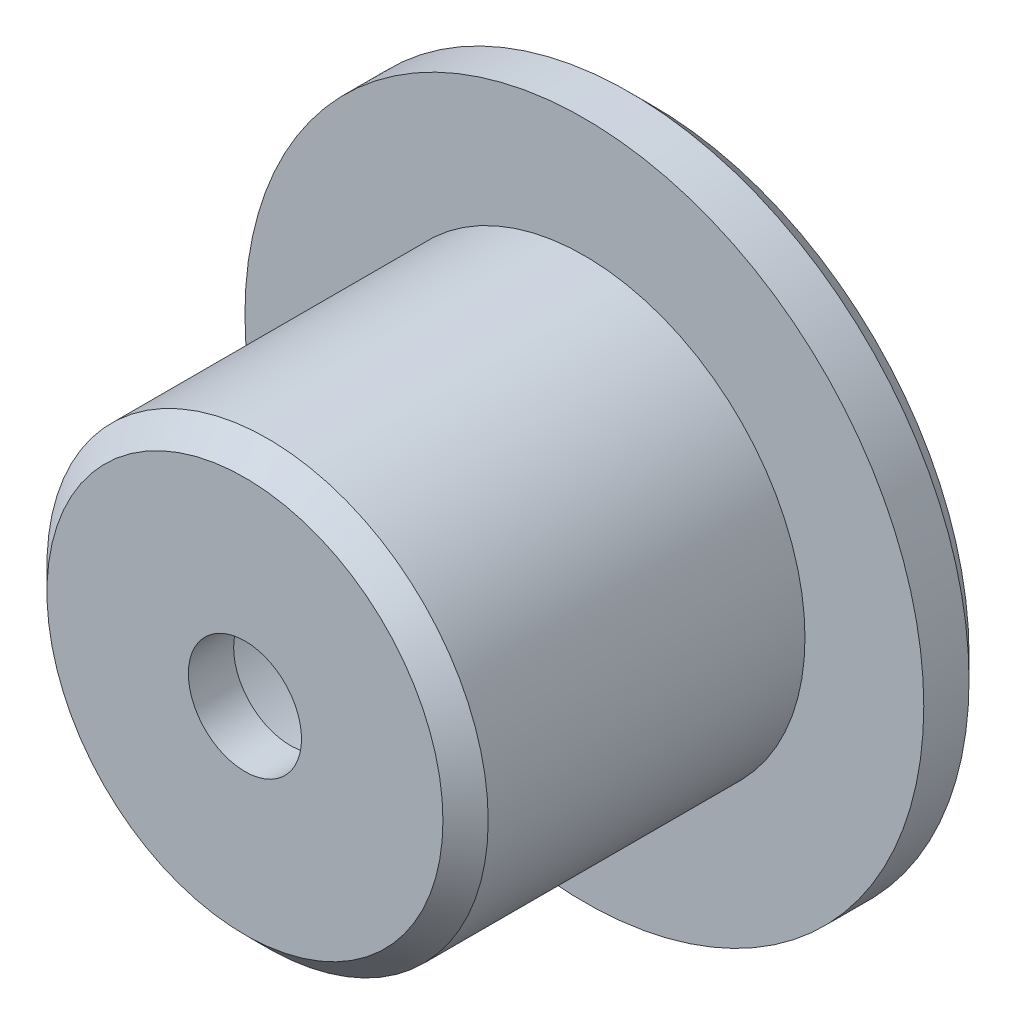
SolidWorks part; units mm, degrees
ref_plane "前视基准面" through (0, 0, 0) normal (0, 0, 1) x (1, 0, 0)
ref_plane "上视基准面" through (0, 0, 0) normal (0, 1, 0) x (1, 0, 0)
ref_plane "右视基准面" through (0, 0, 0) normal (1, 0, 0) x (0, 0, -1)
sketch "草图1" plane through (0, 0, 0) normal (0, 0, 1) x (1, 0, 0)
  circle A0 centre (0, 0) radius 15
  dimension "D1" = 30
extrude "凸台-拉伸1" add sketch "草图1" along normal blind 3
sketch "草图2" plane through (0, 0, 3) normal (0, 0, 1) x (1, 0, 0)
  circle A0 centre (0, 0) radius 9.75
  dimension "D1" = 19.5
extrude "凸台-拉伸2" add sketch "草图2" along normal blind 15
sketch "草图3" plane through (0, 0, 0) normal (0, 0, -1) x (-1, 0, 0)
  circle A0 centre (0, 0) radius 7
  dimension "D1" = 14
extrude "切除-拉伸1" cut sketch "草图3" against normal blind 16
sketch "草图4" plane through (0, 0, 16) normal (0, 0, -1) x (-1, 0, 0)
  circle A0 centre (0, 0) radius 2.5
  dimension "D1" = 5
extrude "切除-拉伸2" cut sketch "草图4" against normal blind 14
chamfer "倒角1" distance 1 angle 45 3 edges at (-7, 0, 0) (15, 0, 0) (9.75, 0, 18)
